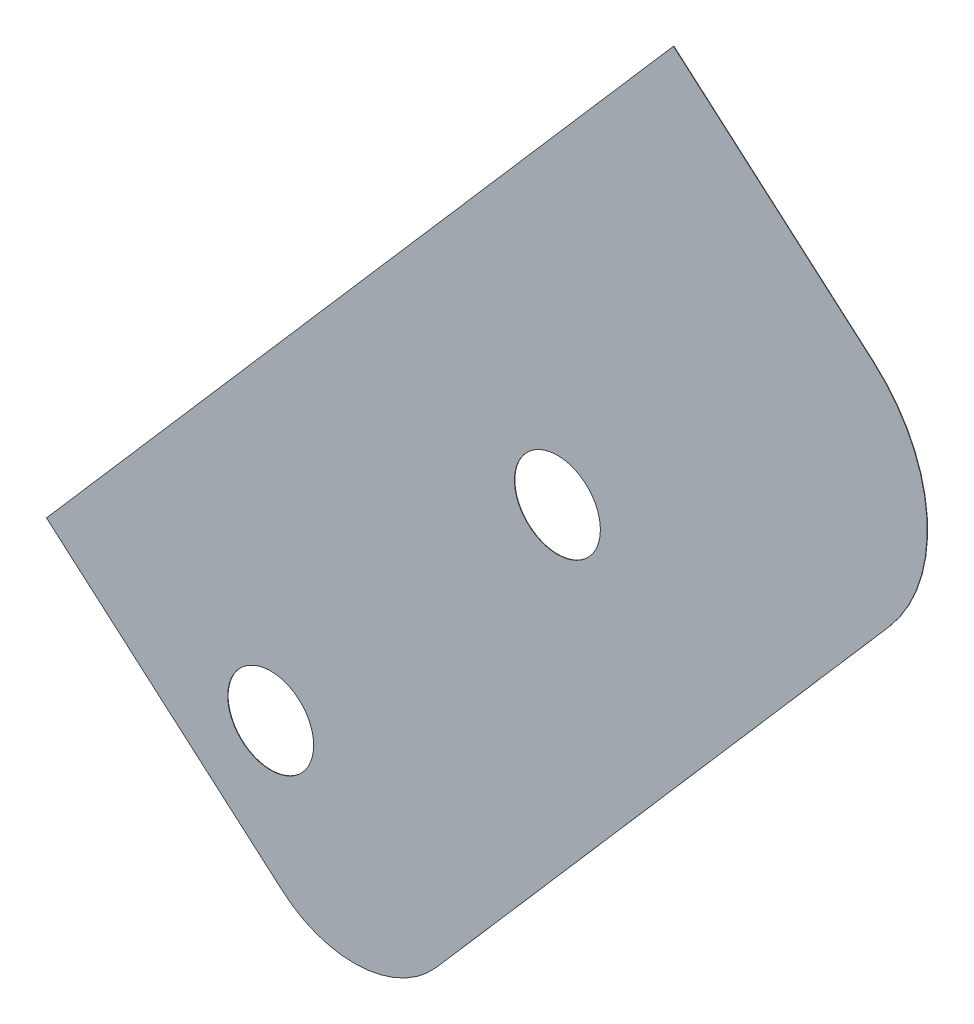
SolidWorks part; units mm, degrees
ref_plane "Front" through (0, 0, 0) normal (0, 0, 1) x (1, 0, 0)
ref_plane "Top" through (0, 0, 0) normal (0, 1, 0) x (1, 0, 0)
ref_plane "Right" through (0, 0, 0) normal (1, 0, 0) x (0, 0, -1)
sketch "Sketch1" plane through (0, 0, 0) normal (0, 0, 1) x (1, 0, 0)
  line L8 (-621.9505, -66.4447) -> (-634.9914, -55.1196)
  line L9 (-650.4904, -114.9973) -> (-620.9286, -80.9567)
  line L10 (-675.9616, -102.2969) -> (-660.5235, -115.7038)
  line L11 (-634.9914, -55.1196) -> (-675.9616, -102.2969)
  line L12 (-621.9505, -66.4447) -> (-634.9914, -55.1196)
  line L13 (-650.4904, -114.9973) -> (-620.9286, -80.9567)
  line L14 (-675.9616, -102.2969) -> (-660.5235, -115.7038)
  line L15 (-634.9914, -55.1196) -> (-675.9616, -102.2969)
  arc A4 (-620.9286, -80.9567) -> (-621.9505, -66.4447) centre (-628.6956, -74.2116) ccw
  arc A5 (-660.5235, -115.7038) -> (-650.4904, -114.9973) centre (-655.8602, -110.334) ccw
  arc A6 (-620.9286, -80.9567) -> (-621.9505, -66.4447) centre (-628.6956, -74.2116) ccw
  arc A7 (-660.5235, -115.7038) -> (-650.4904, -114.9973) centre (-655.8602, -110.334) ccw
  dimension "D1" = 0.508
extrude "Boss-Extrude1" add sketch "Sketch1" along normal blind 0.0254 separate body
hole_wizard "Hole1" positions "Point_Sketch" profile "Profil_Sketch" hole size "Ø0.15" standard "ISO"
sketch "Point_Sketch" plane through (-664.965, -95.8405, 0.0254) normal (0, 0, -1) x (1, 0, 0)
  point P0 (3.6543, 10.6011)
  point P2 (22.3906, -10.9738)
sketch "Profil_Sketch" plane through (-661.3107, -106.4416, 0.0254) normal (1, 0, 0) x (0, -1, 0)
  line L0 (0, 0) -> (0, 0.0254)
  line L1 (0, 0.0254) -> (2.8067, 0.0254)
  line L2 (2.8067, 0.0254) -> (2.8067, 0)
  line L5 (2.8067, 0) -> (0, 0)
  line L11 (0, -6.35) -> (0, 107.95) construction
  dimension "Diameter" = 5.6134
  dimension "Thru Hole Depth" = 0.0254
other "usin_DL090_10-24x1.75-SHCS<1>"
